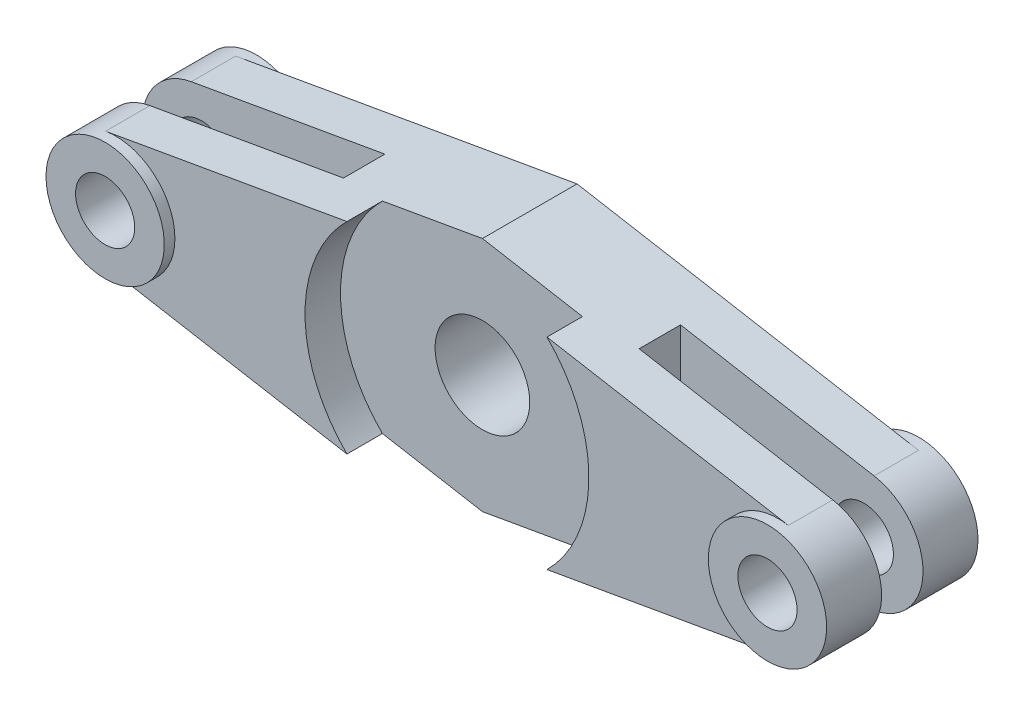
SolidWorks part; units mm, degrees
ref_plane "Plan1" through (0, 0, 0) normal (0, 0, 1) x (1, 0, 0)
ref_plane "Plan2" through (0, 0, 0) normal (0, 1, 0) x (1, 0, 0)
ref_plane "Plan3" through (0, 0, 0) normal (1, 0, 0) x (0, 0, -1)
sketch "Esquisse1" plane through (0, 0, 0) normal (0, 0, 1) x (1, 0, 0)
  line L0 (-32.2906, 0) -> (48.1211, 0) construction
  line L1 (0, 0) -> (0, 15.6431) construction
  line L2 (0, 10) -> (28.8659, 4.9245)
  line L3 (0, -10) -> (28.8659, -4.9245)
  line L4 (0, -10) -> (-28.8659, -4.9245)
  line L5 (0, 10) -> (-28.8659, 4.9245)
  circle A0 centre (28, 0) radius 2.5
  arc A1 (28.8659, -4.9245) -> (28.8659, 4.9245) centre (28, 0) ccw
  arc A2 (-28.8659, -4.9245) -> (-28.8659, 4.9245) centre (-28, 0) cw
  circle A3 centre (-28, 0) radius 2.5
  dimension "D1" = 5
  dimension "D2" = 10
  dimension "D3" = 28
  dimension "D4" = 20
extrude "Base-Extrusion" add sketch "Esquisse1" along normal mid plane 11
sketch "Esquisse2" plane through (0, 0, 5.5) normal (0, 0, 1) x (1, 0, 0)
  line L0 (0, 0) -> (0, 16.7932) construction
  circle A0 centre (28, 0) radius 5
  circle A1 centre (28, 0) radius 2.5 construction
  circle A2 centre (28, 0) radius 2.5
  circle A3 centre (-28, 0) radius 5
  circle A4 centre (-28, 0) radius 2.5
  dimension "D1" = 10
extrude "Boss.-Extru.1" add sketch "Esquisse2" along normal blind 0.9
mirror "Symétrie1" about plane through (0, 0, 0) normal (0, 0, 1)
sketch "Esquisse3" plane through (0, 0, 0) normal (0, 0, 1) x (1, 0, 0)
  line L0 (0, 0) -> (31.8565, 0) construction
  line L1 (0, 0) -> (0, 17.8059) construction
  line L2 (12.5, 11.308) -> (12.5, -12.4895)
  line L3 (12.5, 11.308) -> (35.8228, 11.308)
  line L4 (35.8228, 11.308) -> (35.8228, 0)
  line L5 (35.8228, 0) -> (35.8228, -12.4895)
  line L6 (35.8228, -12.4895) -> (12.5, -12.4895)
  dimension "D1" = 25
extrude "Enlèv. mat.-Extru.1" cut sketch "Esquisse3" against normal mid plane 3.5
mirror "Symétrie2" about plane through (0, 0, 0) normal (1, 0, 0)
sketch "Esquisse4" plane through (0, 0, 5.5) normal (0, 0, 1) x (1, 0, 0)
  circle A0 centre (0, 0) radius 12
  dimension "D1" = 24
extrude "Enlèv. mat.-Extru.2" cut sketch "Esquisse4" against normal blind 3
sketch "Esquisse5" plane through (0, 0, 2.5) normal (0, 0, 1) x (1, 0, 0)
  circle A0 centre (0, 0) radius 4
  dimension "D1" = 8
extrude "Enlèv. mat.-Extru.3" cut sketch "Esquisse5" against normal through all
